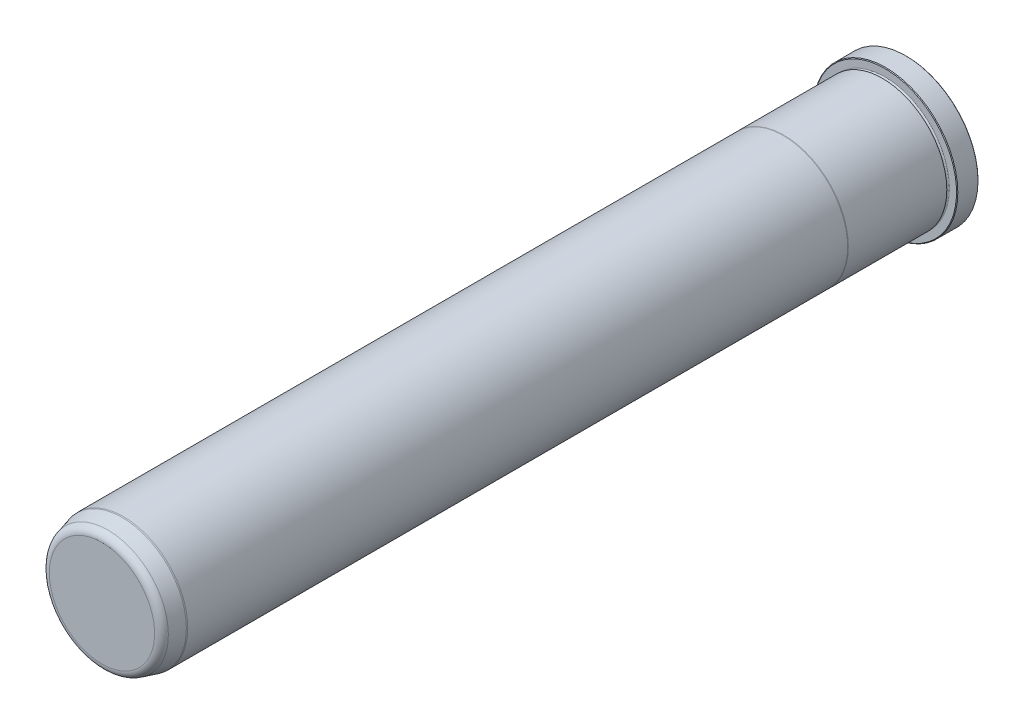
SolidWorks part; units mm, degrees
ref_plane "Front Plane" through (0, 0, 0) normal (0, 0, 1) x (1, 0, 0)
ref_plane "Top Plane" through (0, 0, 0) normal (0, 1, 0) x (1, 0, 0)
ref_plane "Right Plane" through (0, 0, 0) normal (1, 0, 0) x (0, 0, -1)
sketch "Sketch1" plane through (0, 0, 0) normal (1, 0, 0) x (0, 0, -1)
  line L0 (0, 0) -> (0, 42.7355)
  line L1 (0, 42.7355) -> (-12.7, 42.7355)
  line L2 (-12.7, 42.7355) -> (-12.7, 38.0873)
  line L3 (-7.9248, 37.3253) -> (-9.4488, 37.3253) construction
  line L4 (-14.224, 38.0873) -> (-14.224, 38.1127)
  line L5 (-14.224, 38.1127) -> (-72.5348, 38.1127)
  line L6 (-72.5348, 38.1127) -> (-72.898, 38.0873)
  line L7 (-72.898, 38.0873) -> (-463.55, 38.0873)
  line L9 (-476.25, 34.8219) -> (-476.25, 0)
  line L10 (-476.25, 0) -> (0, 0)
  line L11 (0, 0) -> (13.6287, 0) construction
  line L12 (-463.55, 38.0873) -> (-464.312, 38.0206)
  line L13 (-464.312, 38.0206) -> (-476.25, 34.8219)
  arc A0 (-14.224, 38.0873) -> (-12.7, 38.0873) centre (-13.462, 38.0873) ccw
  dimension "D14" = 1.524
  dimension "D1" = 12.7
  dimension "D2" = 1.524
  dimension "D3" = 85.471
  dimension "D4" = 76.2254
  dimension "D5" = 72.898
  dimension "D6" = 476.25
  dimension "D7" = 0.7874
  dimension "D8" = 4
  dimension "D9" = 76.1746
  dimension "D10" = 5
  dimension "D11" = 15
  dimension "D12" = 0.762
  dimension "D13" = 12.7
revolve "Revolve1" add sketch "Sketch1" angle 360 about L11
fillet "Fillet6" radius 4.7625 1 edges at (34.8219, 0, 476.25)
chamfer "Chamfer1" distance 0.381 angle 45 2 edges at (42.7355, 0, 0) (42.7355, 0, 12.7)
